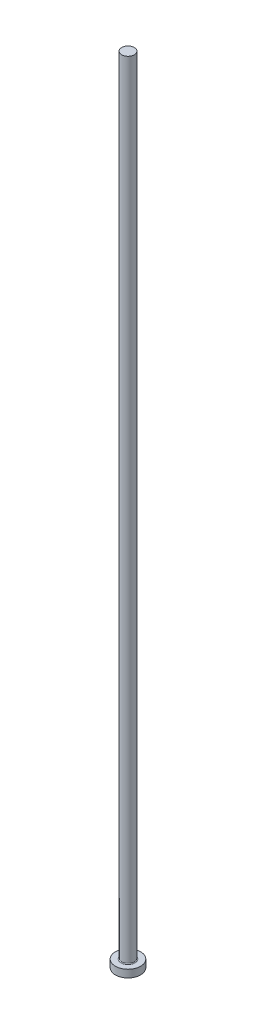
SolidWorks part; units mm, degrees
ref_plane "Plano frontal" through (0, 0, 0) normal (0, 0, 1) x (1, 0, 0)
ref_plane "Plano superior" through (0, 0, 0) normal (0, 1, 0) x (1, 0, 0)
ref_plane "Plano direito" through (0, 0, 0) normal (1, 0, 0) x (0, 0, -1)
sketch "Esboço1" plane through (0, 0, 0) normal (0, 0, 1) x (1, 0, 0)
  line L0 (0, 0) -> (5, 0)
  line L1 (5, 0) -> (5, 3)
  line L2 (5, 3) -> (2.8, 3)
  line L3 (2.5, 3.3) -> (2.5, 315)
  line L4 (2.5, 315) -> (0, 315)
  line L5 (0, 315) -> (0, 0) construction
  line L6 (0, 0) -> (0, 315)
  arc A0 (2.8, 3) -> (2.5, 3.3) centre (2.8, 3.3) cw
  dimension "D3" = 0.3
  dimension "D1" = 10
  dimension "D2" = 5
  dimension "D4" = 3
  dimension "D5" = 315
revolve "Revolução1" add sketch "Esboço1" angle 360 about L5
sketch "Esboço2"
  dimension "D1" = 0.375
  dimension "D2" = 0.875
  dimension "D3" = 0.5625
  dimension "D4" = 2.6875
wrap "Envolver1" sketch "Esboço2" wrap type deboss source sketch "Esboço2" thickness 0.1 parameters "D1"=0.1
